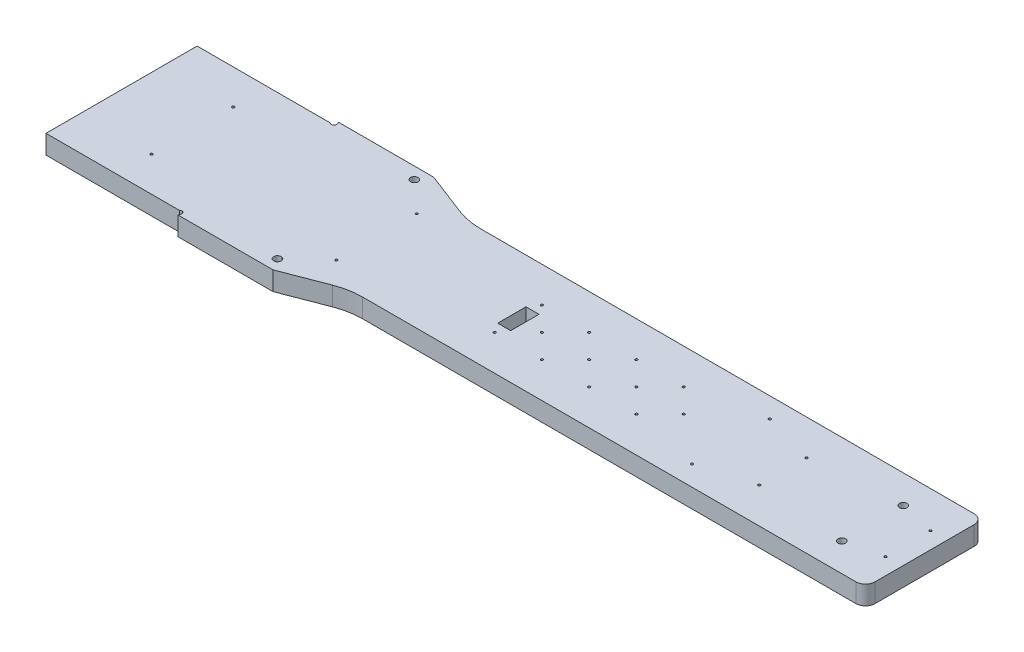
SolidWorks part; units mm, degrees
ref_plane "Plan de face" through (0, 0, 0) normal (0, 0, 1) x (1, 0, 0)
ref_plane "Plan de dessus" through (0, 0, 0) normal (0, 1, 0) x (1, 0, 0)
ref_plane "Plan de droite" through (0, 0, 0) normal (1, 0, 0) x (0, 0, -1)
sketch "Esquisse1" plane through (0, 0, 0) normal (0, 1, 0) x (1, 0, 0)
  line L0 (0, -31.7796) -> (0, 81.5406) construction
  line L1 (-7.5749, 0) -> (364.7719, 0) construction
  line L2 (340, -29.0328) -> (340, 81.5406) construction
  line L3 (-7.5749, 34) -> (331.5519, 34) construction
  line L4 (331.5519, 25) -> (77.846, 25) construction
  line L5 (100, 67.59) -> (100, 7.2958) construction
  line L6 (127.0812, -25) -> (336, -25)
  line L7 (98.1353, 34) -> (116.2993, 27.0045)
  line L8 (50, -67.7319) -> (50, 7.2958) construction
  line L9 (127.0812, 25) -> (336, 25)
  line L10 (98.1353, -34) -> (116.2993, -27.0045)
  line L11 (85, 60.1053) -> (85, -30.5905) construction
  line L12 (144.6041, 43.5) -> (64.0792, 43.5) construction
  line L13 (98.1353, 34) -> (58, 34)
  line L14 (-20, -67.7319) -> (-20, 7.2958) construction
  line L15 (98.1353, -34) -> (58, -34)
  line L16 (340, 21) -> (340, -21)
  line L17 (0, 32) -> (0, -32)
  line L18 (108, -67.7319) -> (108, 11.6063) construction
  line L19 (100, -17) -> (129.5146, -17) construction
  line L20 (280, -29.0328) -> (280, 15.25) construction
  line L21 (52.8929, -34) -> (77.846, -34) construction
  line L22 (-7.5749, -17.3) -> (69.6892, -17.3) construction
  line L23 (53, 24) -> (163, 24) construction
  line L24 (-7.5749, 32) -> (73.9327, 32) construction
  line L25 (58, 56.3012) -> (58, 27.9671) construction
  line L26 (257.7755, -10) -> (284.7572, -10) construction
  line L27 (58, 32) -> (49.7978, 40.2022) construction
  line L28 (257.7755, 10) -> (284.7572, 10) construction
  line L29 (336, 13) -> (287.2641, 13) construction
  line L30 (333, 51.8879) -> (333, 5.2) construction
  line L31 (328.3882, 9.5) -> (353.5657, 9.5) construction
  line L32 (30, -53.9069) -> (30, 7.2958) construction
  line L33 (53, 24) -> (53, -24) construction
  line L34 (58, 33.5556) -> (58, 34)
  line L35 (56.4444, 32) -> (0, 32)
  line L36 (58, -33.5556) -> (58, -34)
  line L37 (56.4444, -32) -> (0, -32)
  line L38 (95, -1.8412) -> (95, -32) construction
  line L39 (88.0938, -29) -> (115.6899, -29) construction
  line L51 (303, -10.8483) -> (303, 51.8879) construction
  line L52 (318, 9.822) -> (318, 34.3488) construction
  line L54 (53, -24) -> (163, -24) construction
  line L57 (163, 24) -> (163, -24) construction
  line L58 (53, 24) -> (163, -24) construction
  line L59 (53, -24) -> (163, 24) construction
  circle A0 centre (30, -17.3) radius 0.5
  arc A1 (336, 25) -> (340, 21) centre (336, 21) cw
  arc A2 (127.0812, 25) -> (116.2993, 27.0045) centre (127.0812, 55) cw
  arc A3 (56.4444, 32) -> (58, 33.5556) centre (57.2222, 32.7778) ccw
  arc A4 (336, -25) -> (340, -21) centre (336, -21) ccw
  arc A5 (127.0812, -25) -> (116.2993, -27.0045) centre (127.0812, -55) ccw
  circle A6 centre (30, 17.3) radius 0.5
  arc A7 (56.4444, -32) -> (58, -33.5556) centre (57.2222, -32.7778) cw
  circle A8 centre (333, -9.5) radius 0.5
  circle A9 centre (108, -17) radius 0.5
  circle A10 centre (108, 17) radius 0.5
  circle A11 centre (280, -10) radius 0.5
  circle A12 centre (333, 9.5) radius 0.5
  circle A13 centre (280, 10) radius 0.5
  circle A14 centre (95, -29) radius 1.6
  circle A15 centre (95, 29) radius 1.6
  circle A22 centre (318, 13) radius 1.6
  circle A23 centre (318, -13) radius 1.6
  point P27 (340, 25)
  point P30 (100, 25)
  point P36 (121.5039, 25)
  point P90 (108, 0)
  point P95 (121.5039, -25)
  dimension "D7" = 4
  dimension "D9" = 30
  dimension "D12" = 70
  dimension "D13" = 3
  dimension "D15" = 2
  dimension "D18" = 17.3
  dimension "D23" = 30
  dimension "D25" = 10
  dimension "D14" = 17
  dimension "D8" = 20
  dimension "D20" = 60
  dimension "D1" = 340
  dimension "D2" = 34
  dimension "D3" = 25
  dimension "D4" = 100
  dimension "D5" = 15
  dimension "D6" = 9.5
  dimension "D10" = 7
  dimension "D11" = 13
  dimension "D16" = 58
  dimension "D17" = 45
  dimension "D19" = 58
  dimension "D21" = 10
  dimension "D22" = 10
  dimension "D24" = 9.5
  dimension "D26" = 5
  dimension "D32" = 30
  dimension "D33" = 15
extrude "Boss.-Extru.1" add sketch "Esquisse1" along normal blind 8
sketch "Esquisse4" plane through (0, 0, 0) normal (0, -1, 0) x (1, 0, 0)
  line L0 (333, 38.6217) -> (333, 8.4032) construction
  line L1 (238, 38.6217) -> (238, -2.6016) construction
  line L2 (228, 38.6217) -> (228, -2.6016) construction
  line L3 (-7.6195, 0) -> (205.0141, 0) construction
  line L4 (218, 38.6217) -> (218, -2.6016) construction
  line L5 (187.2354, 10) -> (205.0141, 10) construction
  line L6 (163, -60.0447) -> (163, 38.6217) construction
  line L7 (0, -60.0447) -> (0, 46.3603) construction
  line L8 (168, -35.6563) -> (168, 17.1536) construction
  line L10 (165.25, -6) -> (170.75, -6)
  line L11 (165.25, -6) -> (165.25, 6)
  line L12 (165.25, 6) -> (170.75, 6)
  line L13 (170.75, -6) -> (170.75, 6)
  line L14 (165.25, -6) -> (170.75, 6) construction
  line L15 (165.25, 6) -> (170.75, -6) construction
  circle A0 centre (238, 0) radius 0.5
  circle A1 centre (228, 10) radius 0.5
  circle A2 centre (228, -10) radius 0.5
  circle A3 centre (208, -10) radius 0.5
  circle A4 centre (218, 0) radius 0.5
  circle A5 centre (208, 10) radius 0.5
  circle A6 centre (188, -10) radius 0.5
  circle A7 centre (198, 0) radius 0.5
  circle A8 centre (188, 10) radius 0.5
  circle A9 centre (168, -10) radius 0.5
  circle A10 centre (178, 0) radius 0.5
  circle A11 centre (168, 10) radius 0.5
  circle A18 centre (128, -10) radius 0.5
  circle A19 centre (128, 10) radius 0.5
  circle A20 centre (148, -10) radius 0.5
  circle A21 centre (148, 10) radius 0.5
  circle A22 centre (138, 0) radius 0.5
  circle A23 centre (158, 0) radius 0.5
  point P44 (168, 0)
  dimension "D5" = 6
  dimension "D1" = 10
  dimension "D2" = 10
  dimension "D3" = 95
  dimension "D4" = 10
  dimension "D6" = 163
  dimension "D7" = 5
extrude "Enlèv. mat.-Extru.2" cut sketch "Esquisse4" against normal blind 8
sketch "Esquisse6" plane through (0, 0, 0) normal (0, -1, 0) x (1, 0, 0)
  line L0 (333, 34.0353) -> (333, -1.8874) construction
  line L2 (313.6169, 0) -> (223.1855, 0) construction
  line L3 (258, 34.0353) -> (258, -1.8874) construction
  line L4 (205.068, 21.5) -> (220.3741, 21.5) construction
  line L5 (127.0812, 25) -> (336, 25) construction
  circle A0 centre (258, 16.5) radius 0.5
  circle A1 centre (258, -16.5) radius 0.5
  dimension "D1" = 75
  dimension "D2" = 3.5
extrude "Enlèv. mat.-Extru.4" cut sketch "Esquisse6" against normal blind 8
sketch "Esquisse8" plane through (0, 0, 0) normal (0, -1, 0) x (1, 0, 0)
  line L0 (317.337, 0) -> (260.5126, 0) construction
  line L1 (340, 35.5604) -> (340, 4.9606) construction
  line L2 (340, 21) -> (340, -21) construction
  line L3 (310, 16.8713) -> (310, 35.5604) construction
  line L4 (270, 16.8713) -> (270, 35.5604) construction
  line L5 (290, 30.5008) -> (290, -4.3694) construction
  line L6 (310.3, -2.2804) -> (310.3, -10.3)
  line L7 (269.7, 10.3) -> (277.7196, 10.3)
  line L8 (269.7, 10.3) -> (269.7, -10.3)
  line L9 (269.7, -10.3) -> (277.7196, -10.3)
  line L10 (310.3, 10.3) -> (310.3, 2.2804)
  line L11 (269.7, 10.3) -> (310.3, -10.3) construction
  line L12 (269.7, -10.3) -> (310.3, 10.3) construction
  line L13 (282.2804, -10.3) -> (310.3, -10.3)
  line L14 (282.2804, 10.3) -> (310.3, 10.3)
  arc A0 (310.3, -2.2804) -> (310.3, 2.2804) centre (310, 0) ccw
  arc A1 (282.2804, 10.3) -> (277.7196, 10.3) centre (280, 10) ccw
  arc A2 (277.7196, -10.3) -> (282.2804, -10.3) centre (280, -10) ccw
  point P22 (290, 0)
  dimension "D1" = 40
  dimension "D2" = 30
  dimension "D3" = 20
extrude "Enlèv. mat.-Extru.5" cut sketch "Esquisse8" against normal blind 6
